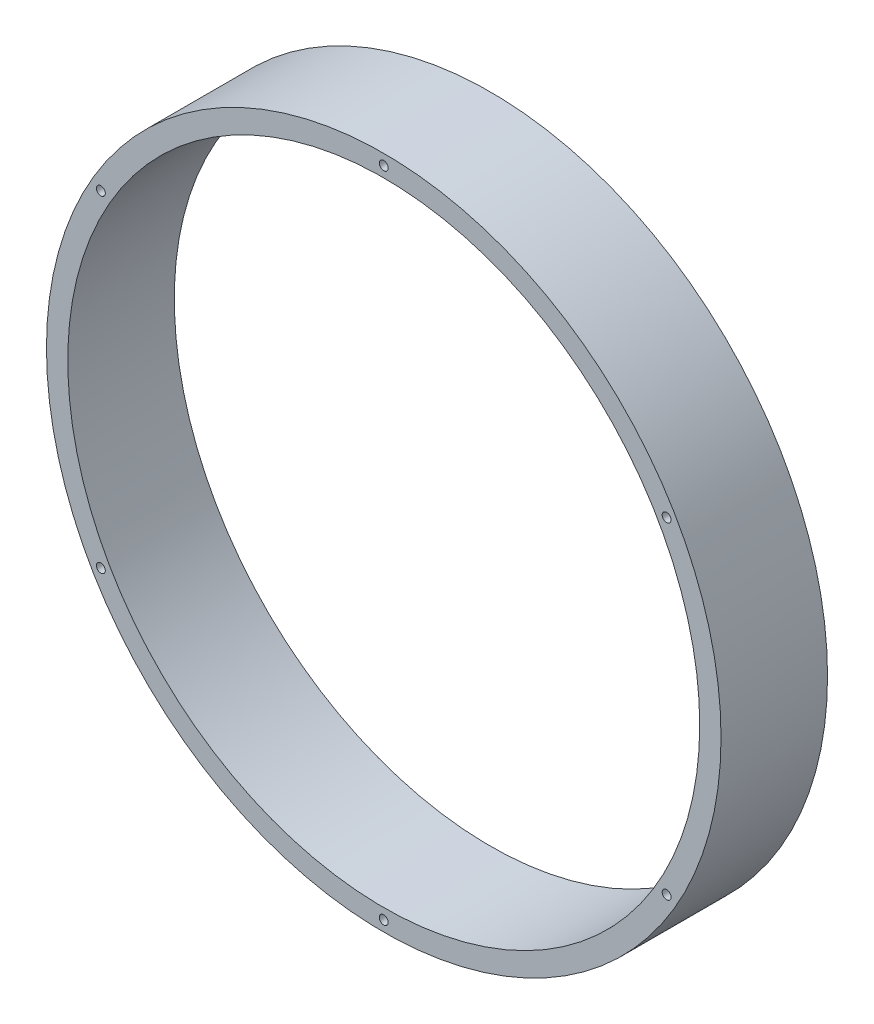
SolidWorks part; units mm, degrees
ref_plane "前视基准面" through (0, 0, 0) normal (0, 0, 1) x (1, 0, 0)
ref_plane "上视基准面" through (0, 0, 0) normal (0, 1, 0) x (1, 0, 0)
ref_plane "右视基准面" through (0, 0, 0) normal (1, 0, 0) x (0, 0, -1)
other "Configuration Table"
sketch "草图1" plane through (0, 0, 0) normal (0, 0, 1) x (1, 0, 0)
  circle A0 centre (0, 0) radius 95
  dimension "D1" = 190
extrude "拉伸-薄壁1" add sketch "草图1" along normal blind 30 thin
sketch "草图2" plane through (0, 0, 30) normal (0, 0, 1) x (1, 0, 0)
  circle A0 centre (0, 0) radius 89 construction
  circle A1 centre (0, 0) radius 89 construction
  circle A2 centre (0, 0) radius 92 construction
  circle A3 centre (0, 92) radius 1.25
  circle A4 centre (79.6743, 46) radius 1.25
  circle A5 centre (79.6743, -46) radius 1.25
  circle A6 centre (0, -92) radius 1.25
  circle A7 centre (-79.6743, -46) radius 1.25
  circle A8 centre (-79.6743, 46) radius 1.25
  point P20 (0, 0)
  dimension "D2" = 2.5
  dimension "D1" = 3
  dimension "D3" = 6
extrude "切除-拉伸1" cut sketch "草图2" against normal blind 10
sketch "草图3" plane through (0, 0, 30) normal (0, 0, 1) x (1, 0, 0)
  line L0 (0, 0) -> (0, 92) construction
  line L1 (0, 0) -> (-79.6743, 46) construction
  line L2 (0, 0) -> (-47.5, 82.2724) construction
  line L3 (-79.7734, 98.1715) -> (-49.8676, 46.3733)
  line L4 (-79.7734, 98.1715) -> (-45.1324, 118.1715)
  line L5 (-49.8676, 46.3733) -> (-15.2266, 66.3733)
  line L6 (-45.1324, 118.1715) -> (-15.2266, 66.3733)
  line L7 (-79.7734, 98.1715) -> (-15.2266, 66.3733) construction
  line L8 (-49.8676, 46.3733) -> (-45.1324, 118.1715) construction
  circle A0 centre (0, 0) radius 95 construction
  dimension "D1" = 30
  dimension "D2" = 40
extrude "切除-拉伸2" [suppressed] cut sketch "草图3" against normal through all both and the other way through all
